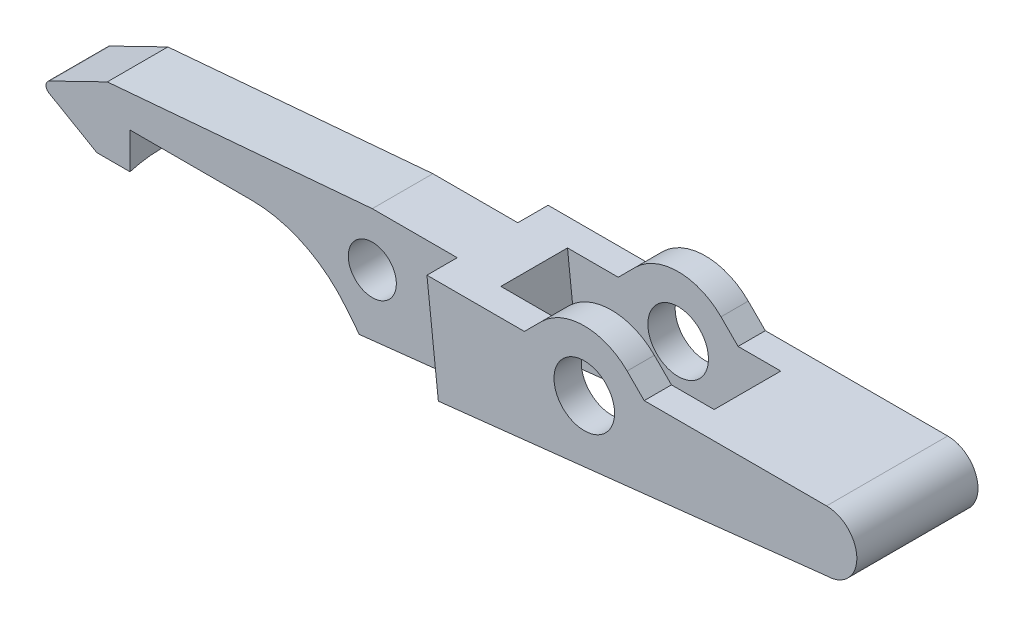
SolidWorks part; units mm, degrees
ref_plane "Front Plane" through (0, 0, 0) normal (0, 0, 1) x (1, 0, 0)
ref_plane "Top Plane" through (0, 0, 0) normal (0, 1, 0) x (1, 0, 0)
ref_plane "Right Plane" through (0, 0, 0) normal (1, 0, 0) x (0, 0, -1)
sketch "Sketch1" plane through (0, 0, 0) normal (0, 0, 1) x (1, 0, 0)
  line L0 (0, 0) -> (0, -0.625)
  line L8 (2, 0) -> (0, 0)
  line L9 (-2.0904, 0) -> (8, 0) construction
  line L10 (0, -0.625) -> (8, -0.625) construction
  line L11 (8, -0.625) -> (8, 0) construction
  line L12 (16, 0.75) -> (16, -0.625) construction
  line L13 (16, -0.625) -> (8, -0.625) construction
  line L15 (16, -1.75) -> (-2.3292, -1.75) construction
  line L17 (0, -0.625) -> (-0.5, -0.625)
  line L18 (-0.5, -0.625) -> (-1.5, -0.0476)
  line L27 (3.7862, -1.031) -> (3.5613, -0.7501)
  line L30 (0, -0.625) -> (0.0412, 0.3741) construction
  line L31 (4, 0.875) -> (7.0108, 0.875)
  line L32 (-0.375, 0.5) -> (4, 0.875)
  line L33 (4, 1.3849) -> (4, 0) construction
  line L34 (4, 0) -> (-1.6383, -1.4262) construction
  line L35 (7.0108, 0.875) -> (7.2929, 1.1571)
  line L36 (8.7071, 1.1571) -> (8.9892, 0.875)
  line L37 (8.9892, 0.875) -> (12, 0.875)
  line L38 (12, -0.125) -> (3.7862, -1.031)
  line L39 (8.9892, 0.875) -> (7.0108, 0.875) construction
  line L40 (8, 0.875) -> (8, 0.45) construction
  line L41 (-1.5, -0.0476) -> (-0.375, 0.5)
  circle A9 centre (4, 0) radius 0.3969
  arc A10 (3.5613, -0.7501) -> (2, 0) centre (2, -2) ccw
  circle A11 centre (4, 0) radius 4.0485 construction
  arc A12 (12, -0.125) -> (12, 0.875) centre (12, 0.375) ccw
  arc A15 (7.2929, 1.1571) -> (8.7071, 1.1571) centre (8, 0.45) cw
  circle A16 centre (8, 0.45) radius 0.5
  point P17 (12.6914, 0.45)
  point P20 (6.9172, 0)
  point P39 (8, 1.45)
  dimension "D5" = 1
  dimension "D7" = 16
  dimension "D11" = 0.5
  dimension "D12" = 2
  dimension "D15" = 0.7937
  dimension "D8" = 12
  dimension "D9" = 0.5
  dimension "D3" = 1.75
  dimension "D19" = 0.375
  dimension "D20" = 2.2
  dimension "D21" = 1
  dimension "D1" = 0.625
  dimension "D2" = 2.625
  dimension "D4" = 0.375
  dimension "D6" = 8
  dimension "D10" = 3.5
  dimension "D13" = 2
  dimension "D14" = 4
  dimension "D16" = 30
  dimension "D17" = 0.5
  dimension "D18" = 1
extrude "Boss-Extrude1" add sketch "Sketch1" along normal blind 2
sketch "Sketch2" plane through (0, 0, 0) normal (1, 0, 0) x (0, 0, -1)
  line L0 (-2, -0.625) -> (0, -0.625) construction
  line L1 (-1, -2.275) -> (-1, -0.625) construction
  circle A0 centre (-1, -2.275) radius 1.75
  dimension "D1" = 3.5
  dimension "D2" = 1.65
extrude "Cut-Extrude1" cut sketch "Sketch2" against normal blind 10
fillet "Fillet1" radius 0.1 1 edges at (-1.5, -0.0476, 1)
sketch "Sketch3" plane through (0.1579, -1.4312, 0) normal (0.1096, -0.994, 0) x (0.994, 0.1096, 0)
  line L0 (-2.6961, 1.5) -> (-2.6961, 0.5) construction
  line L1 (6.2315, 1.55) -> (9.7315, 1.55)
  line L2 (6.2315, 1.55) -> (6.2315, 0.45)
  line L3 (6.2315, 0.45) -> (9.7315, 0.45)
  line L4 (9.7315, 1.55) -> (9.7315, 0.45)
  line L5 (-2.6961, 3.0641) -> (5.4657, 3.0641)
  line L6 (-2.6961, 3.0641) -> (-2.6961, 1.5)
  line L7 (-2.6961, 1.5) -> (5.4657, 1.5)
  line L8 (5.4657, 3.0641) -> (5.4657, 1.5)
  line L9 (-2.6961, 0.5) -> (5.4657, 0.5)
  line L10 (-2.6961, 0.5) -> (-2.6961, -1.2694)
  line L11 (-2.6961, -1.2694) -> (5.4657, -1.2694)
  line L12 (5.4657, 0.5) -> (5.4657, -1.2694)
  line L13 (5.4657, 1.5) -> (5.4657, 0.5) construction
  line L14 (3.6503, 1) -> (5.4657, 1) construction
  line L15 (3.6503, 2) -> (3.6503, 0) construction
  line L16 (5.4657, 1) -> (6.2315, 1) construction
  line L17 (-0.0685, 0) -> (0, 0) construction
  point P19 (-0.0343, 0)
  dimension "D1" = 1
  dimension "D2" = 1.1
  dimension "D3" = 3.5
  dimension "D4" = 5.5
  dimension "D5" = 6.3
extrude "Cut-Extrude2" cut sketch "Sketch3" against normal through all
